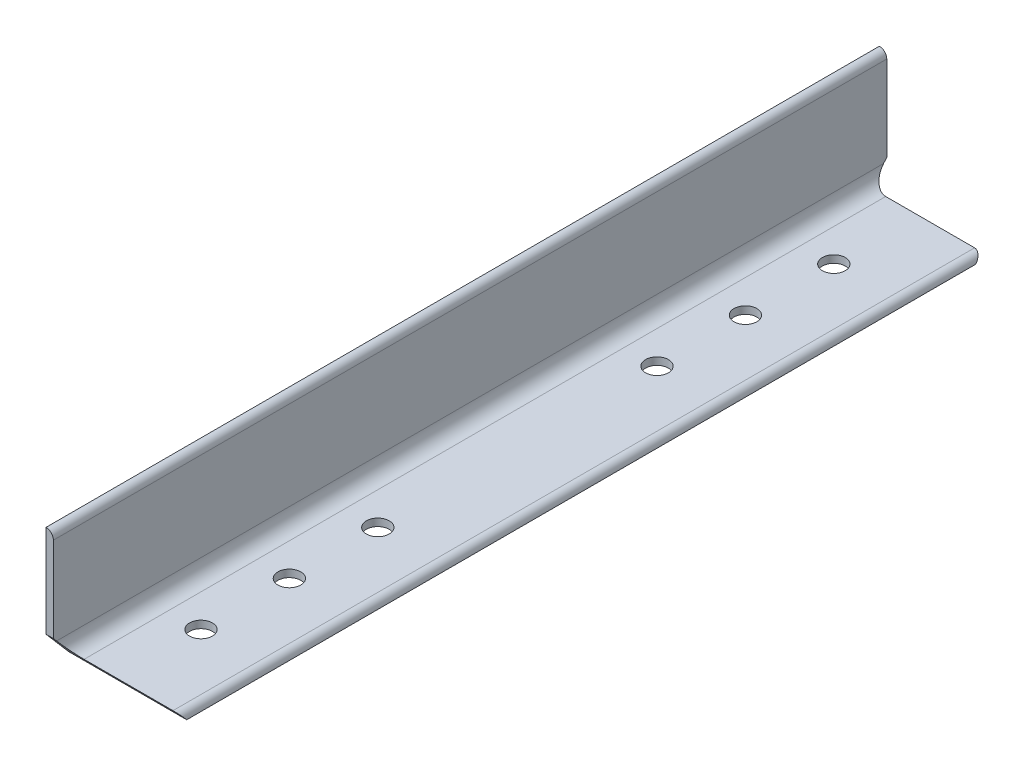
SolidWorks part; units mm, degrees
ref_plane "Front Plane" through (0, 0, 0) normal (0, 0, 1) x (1, 0, 0)
ref_plane "Top Plane" through (0, 0, 0) normal (0, 1, 0) x (1, 0, 0)
ref_plane "Right Plane" through (0, 0, 0) normal (1, 0, 0) x (0, 0, -1)
sketch "L2x2x(1/8)"
  dimension "D4" = 6.35
  dimension "D6" = 3.175
  dimension "D1" = 3.175
  dimension "D2" = 3.175
  dimension "D3" = 50.8
  dimension "D5" = 50.8
  dimension "D7" = 0.0051
  dimension "D8" = 0.0051
  dimension "D9" = 13.4554
  dimension "D10" = 13.4554
sketch "Rivet holes" plane through (0, 0, 0) normal (0, 0, 1) x (1, 0, 0)
  line L0 (-13.4554, -13.4554) -> (-13.4554, 37.3446) construction
  line L1 (5.1424, -8.3062) -> (14.9468, -8.3062)
  line L2 (5.1424, -8.3062) -> (5.1424, -21.0062)
  line L3 (5.1424, -21.0062) -> (14.9468, -21.0062)
  line L4 (14.9468, -8.3062) -> (14.9468, -21.0062)
  line L5 (-19.8305, 14.9468) -> (-7.1305, 14.9468)
  line L6 (-19.8305, 14.9468) -> (-19.8305, 5.1424)
  line L7 (-19.8305, 5.1424) -> (-7.1305, 5.1424)
  line L8 (-7.1305, 14.9468) -> (-7.1305, 5.1424)
  line L11 (37.3446, -13.4554) -> (-13.4554, -13.4554) construction
  point P8 (-19.8305, 10.0446)
  point P9 (10.0446, -21.0062)
  line B0 (10.0446, -2.143) -> (0.5229, -2.143) construction
  line B1 (10.0446, -2.143) -> (10.0446, -6.8928)
  line B2 (-1.8553, -6.8928) -> (21.9445, -6.8928)
  arc B3 (10.0446, -2.143) -> (21.9445, -6.8928) centre (10.0446, -19.4246) cw
  line B4 (-1.4753, 10.0446) -> (-6.2251, 10.0446)
  line B5 (-6.2251, 21.9445) -> (-6.2251, -1.8553)
  arc B6 (-1.4753, 10.0446) -> (-6.2251, -1.8553) centre (-18.7569, 10.0446) cw
  dimension "D1" = 9.8044
  dimension "D2" = 9.8044
  dimension "D3" = 12.7
  dimension "D4" = 12.7
  dimension "D5" = 24.13
  dimension "D6" = 24.13
  dimension "D7" = 2.0752
  dimension "D8" = 2.0752
  dimension "D9" = 23.5001
  dimension "D10" = 23.5001
sketch_block_instance "Block1-1"
sketch_block "Block1" parameters "D1"=4.7498
sketch_block_instance "Block1-2"
extrude "Boss-Extrude1" add sketch "L2x2x(1/8)" along normal blind 357.7457
sketch "Sketch3" plane through (0, 0, 0) normal (1, 0, 0) x (0, 0, -1)
  line L0 (-357.7457, 34.1746) -> (0, 34.1746) construction
  line L1 (-357.7457, -3.9304) -> (-357.7457, 34.1746) construction
  line L2 (0, -3.9304) -> (0, 34.1746) construction
  circle A0 centre (-43.2763, 10.0446) radius 4.9022
  circle A1 centre (-81.1757, 10.0446) radius 4.9022
  circle A2 centre (-119.0752, 10.0446) radius 4.9022
  circle A3 centre (-314.5657, 10.0446) radius 4.9022
  circle A4 centre (-276.6662, 10.0446) radius 4.9022
  circle A5 centre (-238.7667, 10.0446) radius 4.9022
  dimension "D1" = 9.8044
  dimension "D5" = 9.8044
  dimension "D2" = 24.13
  dimension "D3" = 43.2763
  dimension "D6" = 43.18
  dimension "D4" = 3
  dimension "D7" = 3
extrude "Cut-Extrude1" [suppressed] cut sketch "Sketch3" against normal through all
sketch "Sketch6" plane through (0, 0, 0) normal (0, 1, 0) x (1, 0, 0)
  line L0 (34.1746, 0) -> (-3.9304, 0) construction
  line L1 (-50.6357, 27.3733) -> (40.8197, 27.3733)
  line L2 (-50.6357, 27.3733) -> (-50.6357, -9.779)
  line L3 (-50.6357, -9.779) -> (2.4196, -9.779) construction
  line L5 (-41.8653, -347.9667) -> (2.4196, -347.9667) construction
  line L6 (-41.8653, -347.9667) -> (-41.8653, -371.0313)
  line L7 (-41.8653, -371.0313) -> (44.2778, -371.0313)
  line L9 (34.1746, -357.7457) -> (-3.9304, -357.7457) construction
  line L10 (11.9446, -0.254) -> (40.8197, -0.254)
  line L12 (40.8197, -0.254) -> (40.8197, 27.3733)
  line L13 (11.9446, -357.4917) -> (44.2778, -357.4917)
  line L14 (44.2778, -357.4917) -> (44.2778, -371.0313)
  line L15 (37.3446, -357.7457) -> (37.3446, 0) construction
  line L16 (-50.6357, -9.779) -> (-13.4504, -9.779)
  line L17 (-13.4504, -9.779) -> (-2.3429, -0.254)
  line L18 (-2.3429, -0.254) -> (11.9446, -0.254)
  line L19 (-3.9304, -357.7457) -> (-3.9304, 0) construction
  line L21 (-41.8653, -347.9667) -> (-13.4504, -347.9667)
  line L22 (-13.4504, -347.9667) -> (-2.3429, -357.4917)
  line L23 (-2.3429, -357.4917) -> (11.9446, -357.4917)
  line L25 (-13.4504, -357.7457) -> (-13.4504, 0) construction
  arc A0 (2.4196, -9.779) -> (11.9446, -0.254) centre (2.4196, -0.254) ccw construction
  arc A1 (2.4196, -347.9667) -> (11.9446, -357.4917) centre (2.4196, -357.4917) cw construction
  dimension "D1" = 9.525
  dimension "D2" = 9.779
  dimension "D3" = 9.779
  dimension "D4" = 34.925
  dimension "D5" = 0.254
  dimension "D6" = 0.254
  dimension "D7" = 1.5875
  dimension "D8" = 1.5875
extrude "Cut-Extrude4" [suppressed] cut sketch "Sketch6" against normal through all both and the other way through all
sketch "Sketch7" plane through (0, 0, 0) normal (0, 1, 0) x (1, 0, 0)
  line L1 (0, -319.4679) -> (0, -309.6635) construction
  line L2 (0, -281.5684) -> (0, -271.764) construction
  line L3 (0, -243.6689) -> (0, -233.8645) construction
  line L4 (0, -48.1785) -> (0, -38.3741) construction
  line L5 (0, -86.0779) -> (0, -76.2735) construction
  line L6 (0, -123.9774) -> (0, -114.173) construction
  line L7 (34.1746, -357.7457) -> (34.1746, 0) construction
  circle A0 centre (10.0446, -314.5657) radius 4.9022
  circle A1 centre (10.0446, -276.6662) radius 4.9022
  circle A2 centre (10.0446, -238.7667) radius 4.9022
  circle A3 centre (10.0446, -43.2763) radius 4.9022
  circle A4 centre (10.0446, -81.1757) radius 4.9022
  circle A5 centre (10.0446, -119.0752) radius 4.9022
  point P12 (0, -314.5657)
  point P13 (0, -238.7667)
  point P16 (0, -276.6662)
  point P17 (0, -81.1757)
  point P22 (0, -119.0752)
  point P23 (0, -43.2763)
  dimension "D1" = 9.8044
  dimension "D2" = 9.8044
  dimension "D3" = 9.8044
  dimension "D4" = 9.8044
  dimension "D5" = 9.8044
  dimension "D6" = 9.8044
  dimension "D7" = 24.13
extrude "Cut-Extrude5" cut sketch "Sketch7" against normal through all
sketch "Sketch8" plane through (0, 0, 0) normal (1, 0, 0) x (0, 0, -1)
  line L0 (-9.779, -31.3929) -> (-9.779, 2.4196) construction
  line L1 (-9.779, -31.3929) -> (19.7383, -31.3929)
  line L2 (19.7383, -31.3929) -> (19.7383, 42.9661)
  line L3 (-0.254, 11.9446) -> (-0.254, 42.9661)
  line L4 (-0.254, 42.9661) -> (19.7383, 42.9661)
  line L5 (0, -3.9304) -> (0, 34.1746) construction
  line L11 (-357.7457, -3.9304) -> (-357.7457, 34.1746) construction
  line L12 (-347.9667, -24.0857) -> (-347.9667, -13.4504)
  line L13 (-357.4917, 51.1966) -> (-380.4858, 51.1966)
  line L14 (-357.4917, 11.9446) -> (-357.4917, 51.1966)
  line L15 (-380.4858, -24.0857) -> (-380.4858, 51.1966)
  line L16 (-347.9667, -24.0857) -> (-380.4858, -24.0857)
  line L17 (-347.9667, -24.0857) -> (-347.9667, 2.4196) construction
  line L18 (-357.7457, 37.3446) -> (0, 37.3446) construction
  line L19 (-347.9667, -13.4504) -> (-357.4917, -2.3429)
  line L20 (-357.4917, -2.3429) -> (-357.4917, 11.9446)
  line L21 (-357.7457, -3.9304) -> (0, -3.9304) construction
  line L22 (-357.7457, -13.4504) -> (0, -13.4504) construction
  line L23 (-9.779, -31.3929) -> (-9.779, -13.4504)
  line L26 (-9.779, -13.4504) -> (-0.254, -2.3429)
  line L27 (-0.254, -2.3429) -> (-0.254, 11.9446)
  arc A0 (-9.779, 2.4196) -> (-0.254, 11.9446) centre (-0.254, 2.4196) cw construction
  arc A2 (-347.9667, 2.4196) -> (-357.4917, 11.9446) centre (-357.4917, 2.4196) ccw construction
  point P24 (0, 0)
  dimension "D1" = 9.525
  dimension "D6" = 1.5875
  dimension "D2" = 9.779
  dimension "D3" = 9.779
  dimension "D4" = 34.925
  dimension "D5" = 0.254
extrude "Cut-Extrude6" cut sketch "Sketch8" against normal through all both and the other way through all
